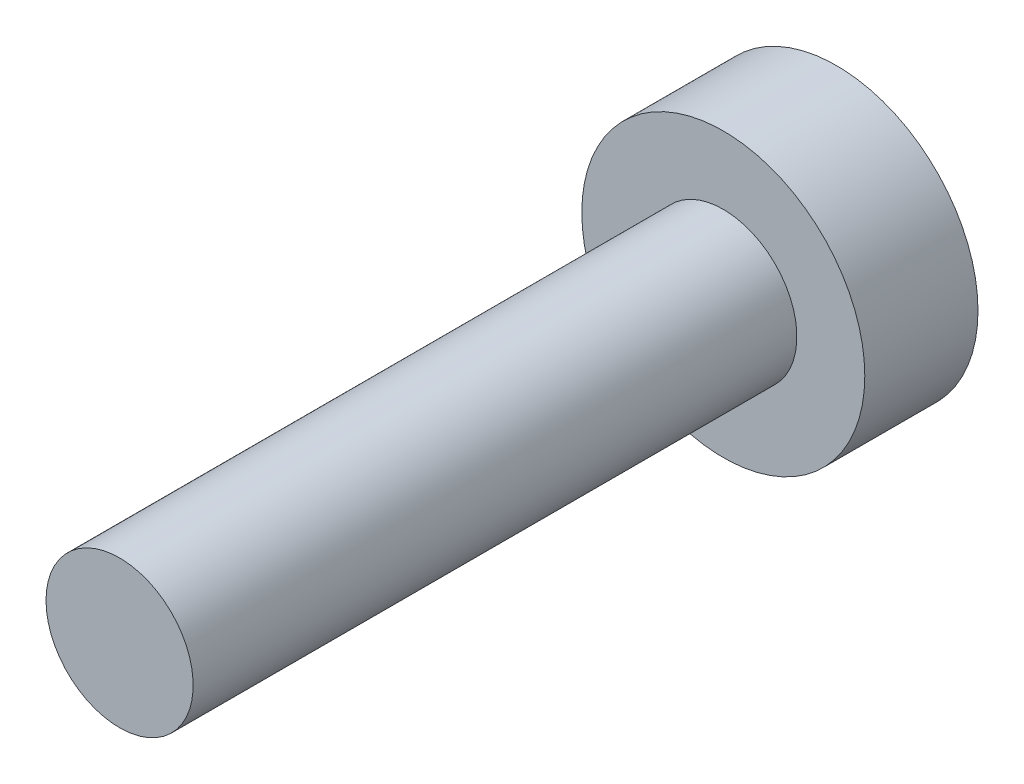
SolidWorks part; units mm, degrees
ref_plane "Plane1" through (0, 0, 0) normal (0, 0, 1) x (1, 0, 0)
ref_plane "Plane2" through (0, 0, 0) normal (0, 1, 0) x (1, 0, 0)
ref_plane "Plane3" through (0, 0, 0) normal (1, 0, 0) x (0, 0, -1)
sketch "Esquisse1" plane through (0, 0, 0) normal (0, 0, 1) x (1, 0, 0)
  circle A0 centre (0, 0) radius 1.95
  dimension "D1" = 3.9
extrude "BaseExtrusion" add sketch "Esquisse1" along normal blind 16
sketch "Esquisse2" plane through (0, 0, 0) normal (0, 0, -1) x (-1, 0, 0)
  circle A0 centre (0, 0) radius 3.75
  dimension "D1" = 7.5
extrude "Bossage-Extrusion1" add sketch "Esquisse2" along normal blind 3
